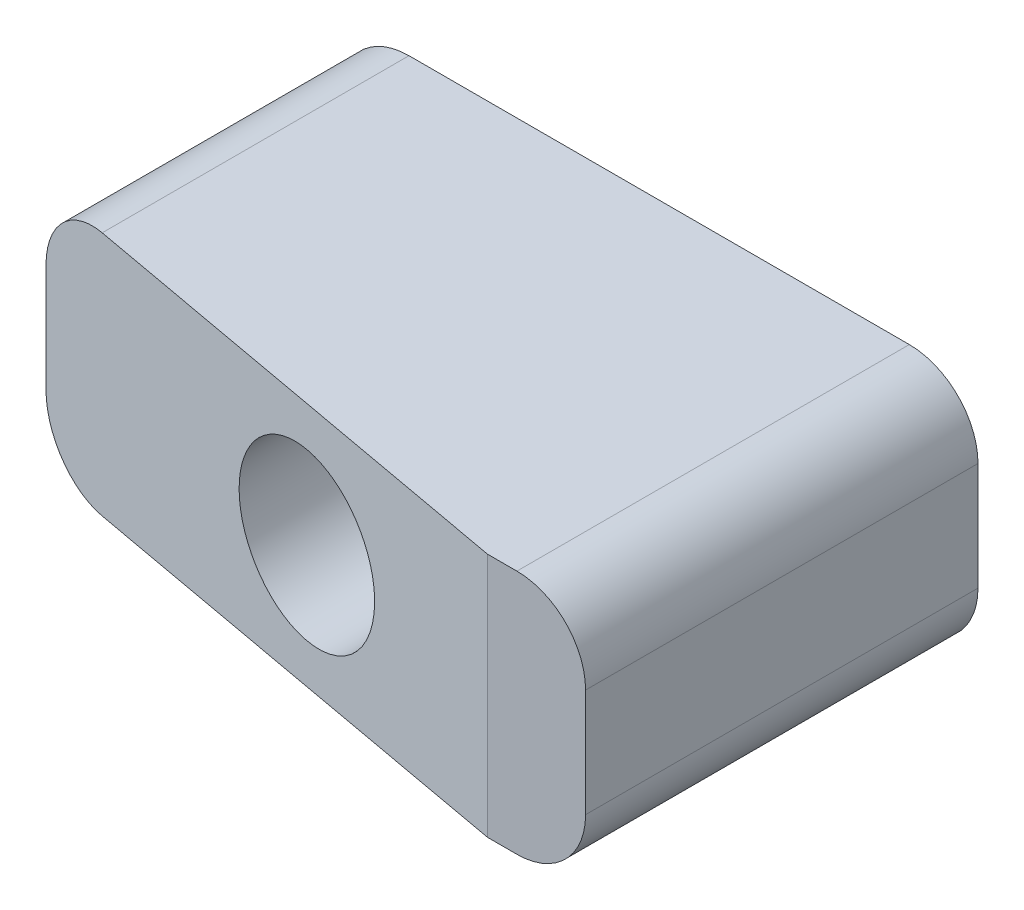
SolidWorks part; units mm, degrees
ref_plane "Front" through (0, 0, 0) normal (0, 0, 1) x (1, 0, 0)
ref_plane "Top" through (0, 0, 0) normal (0, 1, 0) x (1, 0, 0)
ref_plane "Right" through (0, 0, 0) normal (1, 0, 0) x (0, 0, -1)
ref_plane "Plane1"
sketch "Sketch1" plane through (0, 0, 0) normal (0, 0, 1) x (1, 0, 0)
  line L0 (-1116.33, 59.055) -> (-1055.37, 59.055) construction
  line L1 (-1066.419, 81.28) -> (-1098.804, 81.28)
  line L2 (-1061.974, 76.835) -> (-1061.974, 69.85)
  line L3 (-1066.419, 65.405) -> (-1098.804, 65.405)
  line L4 (-1103.249, 76.835) -> (-1103.249, 69.85)
  line L5 (-1055.624, -85.471) -> (-1055.624, 85.471) construction
  arc A0 (-1098.804, 81.28) -> (-1103.249, 76.835) centre (-1098.804, 76.835) ccw
  arc A1 (-1098.804, 65.405) -> (-1103.249, 69.85) centre (-1098.804, 69.85) cw
  arc A2 (-1066.419, 81.28) -> (-1061.974, 76.835) centre (-1066.419, 76.835) cw
  arc A3 (-1061.974, 69.85) -> (-1066.419, 65.405) centre (-1066.419, 69.85) cw
  point P11 (-1103.249, 81.28)
  point P16 (-1061.974, 81.28)
  point P19 (-1061.974, 65.405)
extrude "Boss-Extrude1" add sketch "Sketch1" against normal blind 31.75 flip side to cut
sketch "Sketch2" plane through (0, 65.405, 0) normal (0, -1, 0) x (1, 0, 0)
  line L0 (-1068.324, 0) -> (-1103.249, -6.35)
  line L1 (-1098.804, 0) -> (-1066.419, 0) construction
  line L2 (-1103.249, -31.75) -> (-1103.249, 0) construction
  line L3 (-1061.974, -31.75) -> (-1061.974, 0) construction
  dimension "D1" = 6.35
  dimension "D2" = 6.35
  dimension "D3" = 10.305
extrude "Cut-Extrude1" cut sketch "Sketch2" against normal through all and the other way through all flip side to cut
sketch "Sketch3" plane through (0, 65.405, 0) normal (0, -1, 0) x (1, 0, 0)
  line L0 (-1068.324, 6.35) -> (-1103.249, 0) construction
  line L1 (-1103.249, -31.75) -> (-1103.249, -6.35) construction
  line L2 (-1098.804, -5.5418) -> (-1068.324, 0) construction
  line L3 (-1068.324, 6.35) -> (-1061.974, 6.35) construction
  line L5 (-1061.974, -31.75) -> (-1061.974, 0) construction
  dimension "D1" = 6.35
sketch "Sketch4" plane through (0, 81.28, 0) normal (0, 1, 0) x (1, 0, 0)
  line L0 (-1068.324, -6.35) -> (-1103.249, 0) construction
  line L1 (-1068.324, -6.35) -> (-1061.974, -6.35) construction
  line L2 (-1068.324, -6.35) -> (-1103.249, 0) construction
  line L3 (-1068.324, -6.35) -> (-1061.974, -6.35) construction
hole_wizard "Hole1" positions "Point_Sketch" profile "Profil_Sketch" counterbore size "1/4" standard "ANSI Inch"
sketch "Point_Sketch" plane through (-1095.4806, 74.2775, 0) normal (0, 0, -1) x (1, 0, 0)
  point P0 (12.8691, 0.935)
sketch "Profil_Sketch" plane through (-1082.6115, 73.3425, 0) normal (1, 0, 0) x (0, -1, 0)
  line L0 (0, 0) -> (0, 31.75)
  line L1 (0, 31.75) -> (3.5687, 31.75)
  line L3 (3.5687, 31.75) -> (3.5687, 19.05)
  line L4 (3.5687, 19.05) -> (5.3594, 19.05)
  line L5 (5.3594, 19.05) -> (5.3594, 0)
  line L7 (5.3594, 0) -> (0, 0)
  line L11 (0, -6.35) -> (0, 107.95) construction
  dimension "Diameter" = 7.1374
  dimension "Thru Hole Depth" = 31.75
  dimension "L1" = 19.05
other "usin_LS160_.25x1.25-SHSB-(#10-24)<1>"
other "Move Face1" parameters "D1"=6.35
hole_wizard "Hole11" positions "Point_Sketch1" profile "Profil_Sketch1" legacy
sketch "Point_Sketch1" plane through (-1094.9639, 80.8294, -25.4) normal (0, 0, 1) x (-1, 0, 0)
  point P0 (0.9826, 7.4869)
  point P2 (-25.6874, 7.4869)
sketch "Profil_Sketch1" plane through (-1095.9465, 73.3425, -25.4) normal (1, 0, 0) x (0, 1, 0)
  line L0 (0, 0) -> (0, 0.0001)
  line L1 (0, 0.0001) -> (6.35, 0.0001)
  line L2 (6.35, 0.0001) -> (6.35, 0)
  line L4 (6.35, 0) -> (0, 0)
  line L5 (0, -11.3109) -> (0, 121.1557) construction
  line L6 (0, 0.0001) -> (-6.35, 0.0001) construction
  dimension "Depth" = 0.0001
  dimension "Drill Angle" = 180
  dimension "Diameter" = 12.7
other "usin_FP037_RAYMOND DIE SPRINGS INCH 103-208<1>"
